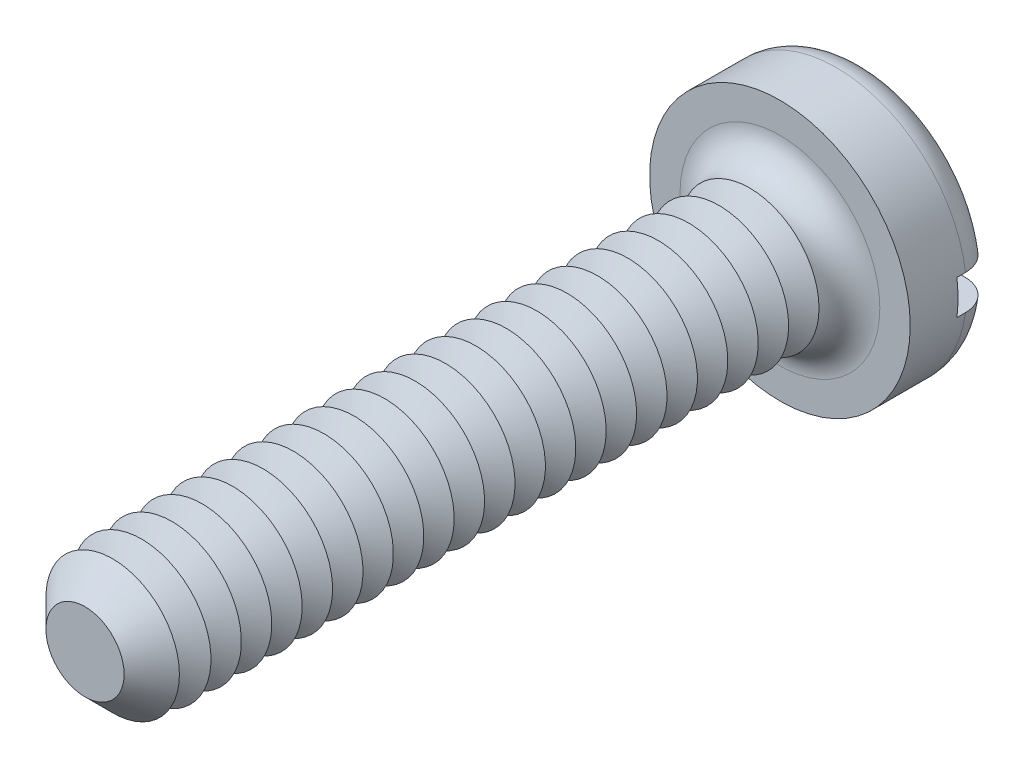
SolidWorks part; units mm, degrees
ref_plane "Front Plane" through (0, 0, 0) normal (0, 0, 1) x (1, 0, 0)
ref_plane "Top Plane" through (0, 0, 0) normal (0, 1, 0) x (1, 0, 0)
ref_plane "Right Plane" through (0, 0, 0) normal (1, 0, 0) x (0, 0, -1)
sketch "Sketch3" plane through (0, 0, 0) normal (0, 0, 1) x (1, 0, 0)
  circle A0 centre (0, 0) radius 1.5
  dimension "D1" = 3
extrude "Boss-Extrude2" add sketch "Sketch3" against normal blind 1
sketch "Sketch4" plane through (0, 0, 0) normal (0, 0, 1) x (1, 0, 0)
  circle A0 centre (0, 0) radius 0.8
  dimension "D1" = 1.6
extrude "Boss-Extrude3" add sketch "Sketch4" along normal blind 8
fillet "Fillet1" radius 0.35 2 edges at (1.5, 0, -1) (0.8, 0, 0)
chamfer "Chamfer1" distance 0.35 angle 45 1 edges at (0.8, 0, 8)
sketch "Sketch5" plane through (0, 0, 0) normal (1, 0, 0) x (0, 0, -1)
  line L0 (1.6944, 0) -> (-7.6738, 0) construction
sketch "Sketch6" plane through (0, 0, 0) normal (1, 0, 0) x (0, 0, -1)
  line L0 (-0.35, 0.8) -> (-0.525, 0.4969)
  line L1 (-0.525, 0.4969) -> (-0.7, 0.8)
  line L2 (-0.35, 0.8) -> (-7.65, 0.8) construction
  line L3 (-0.7, 0.8) -> (-0.35, 0.8)
  dimension "D1" = 0.35
revolve "Cut-Revolve1" cut sketch "Sketch6" angle 360 about L0
pattern_linear "LPattern1" count 21 spacing 0.35 along (0, 0, 1) of "Cut-Revolve1"
sketch "Sketch8" plane through (0, 0, -1) normal (0, 0, -1) x (-1, 0, 0)
  line L1 (1.5, -0.2) -> (-1.5, -0.2)
  line L2 (1.5, -0.2) -> (1.5, 0.2)
  line L3 (1.5, 0.2) -> (-1.5, 0.2)
  line L4 (-1.5, -0.2) -> (-1.5, 0.2)
  line L5 (1.5, -0.2) -> (-1.5, 0.2) construction
  line L6 (1.5, 0.2) -> (-1.5, -0.2) construction
  point P0 (0, 0)
  dimension "D1" = 3
  dimension "D2" = 0.4
extrude "Cut-Extrude1" cut sketch "Sketch8" against normal blind 0.45
